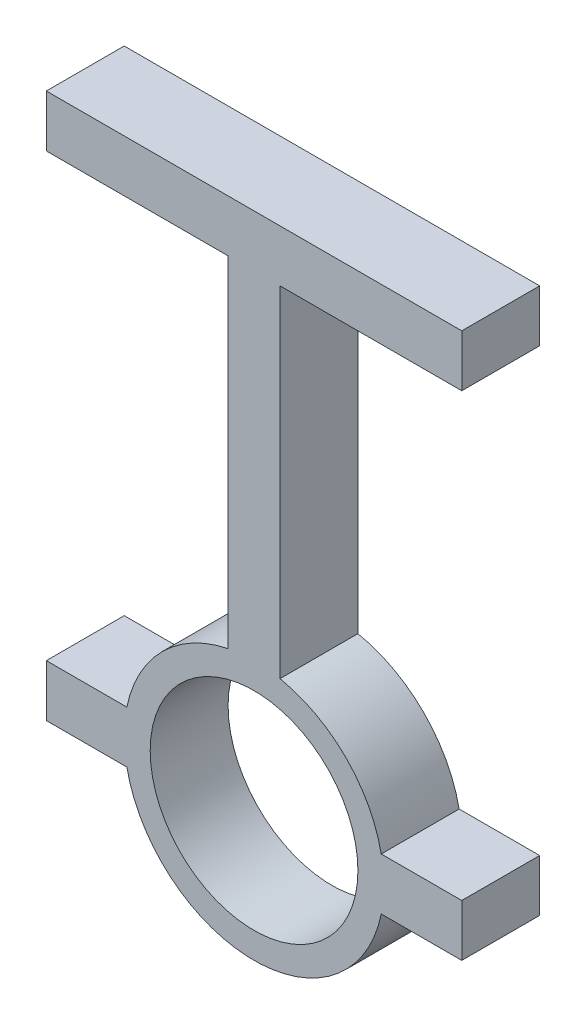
SolidWorks part; units mm, degrees
ref_plane "Plan de face" through (0, 0, 0) normal (0, 0, 1) x (1, 0, 0)
ref_plane "Plan de dessus" through (0, 0, 0) normal (0, 1, 0) x (1, 0, 0)
ref_plane "Plan de droite" through (0, 0, 0) normal (1, 0, 0) x (0, 0, -1)
sketch "Esquisse1" plane through (0, 0, 0) normal (0, 0, 1) x (1, 0, 0)
  line L0 (0, 25) -> (0, 90) construction
  line L1 (5, 24.4949) -> (5, 90)
  line L2 (-5, 24.4949) -> (-5, 90)
  line L3 (-5, 90) -> (-40, 90)
  line L4 (-40, 90) -> (-40, 100)
  line L5 (-40, 100) -> (40, 100)
  line L6 (40, 100) -> (40, 90)
  line L7 (40, 90) -> (5, 90)
  line L8 (-5, 25) -> (-5, 90) construction
  line L9 (5, 25) -> (5, 90) construction
  line L10 (40, 0) -> (-40, 0) construction
  line L11 (40, 5) -> (24.4949, 5)
  line L12 (40, -5) -> (24.4949, -5)
  line L13 (40, -5) -> (40, 5)
  line L14 (-40, -5) -> (-40, 5)
  line L15 (-24.4949, -5) -> (-40, -5)
  line L16 (-24.4949, 5) -> (-40, 5)
  line L17 (40, -5) -> (-40, -5) construction
  line L19 (40, 5) -> (-40, 5) construction
  circle A0 centre (0, 0) radius 20
  arc A1 (-5, 24.4949) -> (-24.4949, 5) centre (0, 0) ccw
  arc A2 (24.4949, 5) -> (5, 24.4949) centre (0, 0) ccw
  circle A3 centre (0, 0) radius 25 construction
  arc A4 (-24.4949, -5) -> (24.4949, -5) centre (0, 0) ccw
  point P14 (0, 100)
  point P18 (23.9076, 7.3093)
  dimension "D1" = 40
  dimension "D5" = 80
  dimension "D6" = 100
  dimension "D7" = 10
  dimension "D8" = 40
  dimension "D9" = 40
  dimension "D2" = 5
  dimension "D3" = 5
  dimension "D4" = 5
  dimension "D10" = 5
  dimension "D11" = 5
extrude "Boss.-Extru.1" add sketch "Esquisse1" along normal blind 15
sketch "Esquisse2" plane through (0, 0, 15) normal (0, 0, 1) x (1, 0, 0)
  line L0 (40, 0) -> (-40, 0)
  line L1 (40, -5) -> (40, 5) construction
  line L2 (-40, 5) -> (-40, -5) construction
